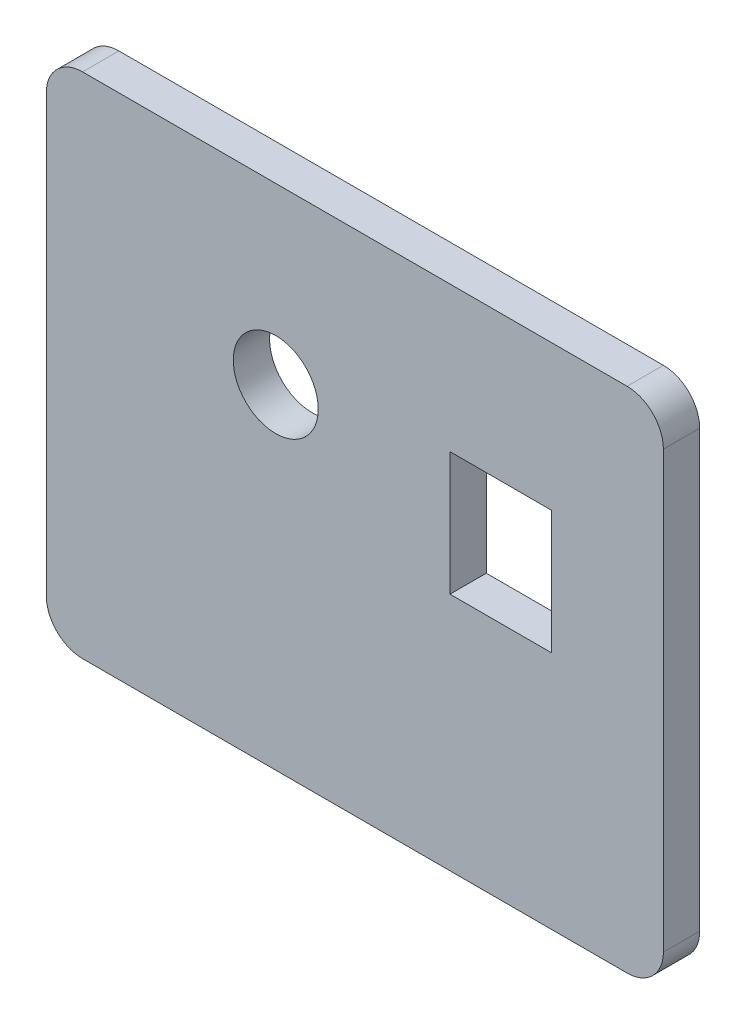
SolidWorks part; units mm, degrees
ref_plane "Front Plane" through (0, 0, 0) normal (0, 0, 1) x (1, 0, 0)
ref_plane "Top Plane" through (0, 0, 0) normal (0, 1, 0) x (1, 0, 0)
ref_plane "Right Plane" through (0, 0, 0) normal (1, 0, 0) x (0, 0, -1)
sketch "Sketch1" plane through (0, 0, 0) normal (0, 0, 1) x (1, 0, 0)
  line L1 (-37.5, 35) -> (37.5, 35)
  line L2 (-42.5, 30) -> (-42.5, -30)
  line L3 (-37.5, -35) -> (37.5, -35)
  line L4 (42.5, 30) -> (42.5, -30)
  line L5 (-42.5, 35) -> (42.5, -35) construction
  line L6 (-42.5, -35) -> (42.5, 35) construction
  arc A0 (42.5, 30) -> (37.5, 35) centre (37.5, 30) ccw
  arc A1 (42.5, -30) -> (37.5, -35) centre (37.5, -30) cw
  arc A2 (-37.5, -35) -> (-42.5, -30) centre (-37.5, -30) cw
  arc A3 (-42.5, 30) -> (-37.5, 35) centre (-37.5, 30) cw
  point P0 (0, 0)
  dimension "D3" = 5
  dimension "D1" = 85
  dimension "D2" = 70
extrude "Boss-Extrude1" add sketch "Sketch1" along normal blind 5
sketch "Sketch2" plane through (0, 0, 5) normal (0, 0, 1) x (1, 0, 0)
  line L0 (0, 50.7719) -> (0, -45.1223) construction
  line L1 (-61.8875, 0) -> (73.2682, 0) construction
  line L2 (37.5, 35) -> (-37.5, 35) construction
  line L4 (13.1049, 15) -> (27.1049, 15)
  line L5 (13.1049, 15) -> (13.1049, -2)
  line L6 (13.1049, -2) -> (27.1049, -2)
  line L7 (27.1049, 15) -> (27.1049, -2)
  line L8 (13.1049, 15) -> (27.1049, -2) construction
  line L9 (13.1049, -2) -> (27.1049, 15) construction
  circle A0 centre (-10.8951, 11) radius 5.85
  point P9 (20.1049, 6.5)
  dimension "D1" = 11.7
  dimension "D2" = 24
  dimension "D6" = 24
  dimension "D3" = 14
  dimension "D4" = 17
  dimension "D5" = 20
extrude "Cut-Extrude1" cut sketch "Sketch2" against normal blind 10
